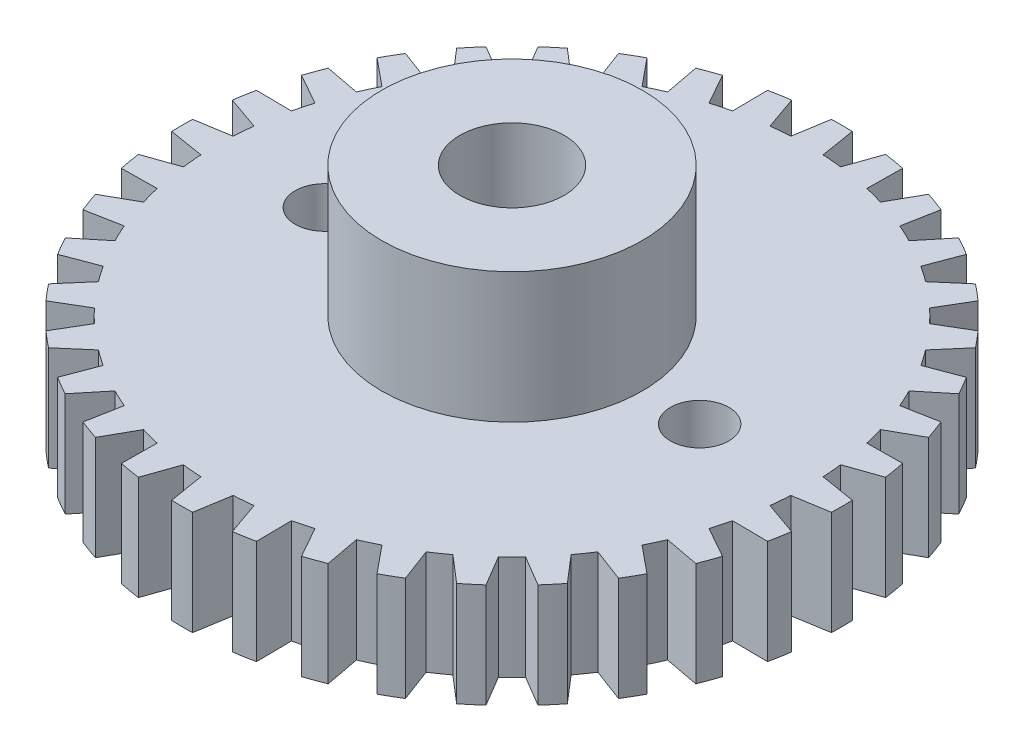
SolidWorks part; units mm, degrees
ref_plane "Front Plane" through (0, 0, 0) normal (0, 0, 1) x (1, 0, 0)
ref_plane "Top Plane" through (0, 0, 0) normal (0, 1, 0) x (1, 0, 0)
ref_plane "Right Plane" through (0, 0, 0) normal (1, 0, 0) x (0, 0, -1)
sketch "Sketch1" plane through (0, 0, 0) normal (0, 1, 0) x (1, 0, 0)
  line L0 (-0.635, 20.0941) -> (-0.9842, 17.969)
  line L1 (0.635, 20.0941) -> (0.9842, 17.969)
  line L2 (4.1147, 19.6785) -> (4.0895, 17.5251)
  line L3 (2.8639, 19.8991) -> (2.151, 17.8669)
  line L4 (7.4693, 18.6651) -> (7.0706, 16.5487)
  line L5 (6.2759, 19.0994) -> (5.2209, 17.2219)
  line L6 (10.597, 17.0845) -> (9.8368, 15.0695)
  line L7 (9.4971, 17.7195) -> (8.1321, 16.0537)
  line L8 (13.4027, 14.9848) -> (12.3042, 13.1324)
  line L9 (12.4298, 15.8011) -> (10.7963, 14.3977)
  line L10 (15.8011, 12.4298) -> (14.3977, 10.7963)
  line L11 (14.9848, 13.4027) -> (13.1324, 12.3042)
  line L12 (17.7195, 9.4971) -> (16.0537, 8.1321)
  line L13 (17.0845, 10.597) -> (15.0695, 9.8368)
  line L14 (19.0994, 6.2759) -> (17.2219, 5.2209)
  line L15 (18.6651, 7.4693) -> (16.5487, 7.0706)
  line L16 (19.8991, 2.8639) -> (17.8669, 2.151)
  line L17 (19.6785, 4.1147) -> (17.5251, 4.0895)
  line L18 (20.0941, -0.635) -> (17.969, -0.9842)
  line L19 (20.0941, 0.635) -> (17.969, 0.9842)
  line L20 (19.6785, -4.1147) -> (17.5251, -4.0895)
  line L21 (19.8991, -2.8639) -> (17.8669, -2.151)
  line L22 (18.6651, -7.4693) -> (16.5487, -7.0706)
  line L23 (19.0994, -6.2759) -> (17.2219, -5.2209)
  line L24 (17.0845, -10.597) -> (15.0695, -9.8368)
  line L25 (17.7195, -9.4971) -> (16.0537, -8.1321)
  line L26 (14.9848, -13.4027) -> (13.1324, -12.3042)
  line L27 (15.8011, -12.4298) -> (14.3977, -10.7963)
  line L28 (12.4298, -15.8011) -> (10.7963, -14.3977)
  line L29 (13.4027, -14.9848) -> (12.3042, -13.1324)
  line L30 (9.4971, -17.7195) -> (8.1321, -16.0537)
  line L31 (10.597, -17.0845) -> (9.8368, -15.0695)
  line L32 (6.2759, -19.0994) -> (5.2209, -17.2219)
  line L33 (7.4693, -18.6651) -> (7.0706, -16.5487)
  line L34 (2.8639, -19.8991) -> (2.151, -17.8669)
  line L35 (4.1147, -19.6785) -> (4.0895, -17.5251)
  line L36 (-0.635, -20.0941) -> (-0.9842, -17.969)
  line L37 (0.635, -20.0941) -> (0.9842, -17.969)
  line L38 (-4.1147, -19.6785) -> (-4.0895, -17.5251)
  line L39 (-2.8639, -19.8991) -> (-2.151, -17.8669)
  line L40 (-7.4693, -18.6651) -> (-7.0706, -16.5487)
  line L41 (-6.2759, -19.0994) -> (-5.2209, -17.2219)
  line L42 (-10.597, -17.0845) -> (-9.8368, -15.0695)
  line L43 (-9.4971, -17.7195) -> (-8.1321, -16.0537)
  line L44 (-13.4027, -14.9848) -> (-12.3042, -13.1324)
  line L45 (-12.4298, -15.8011) -> (-10.7963, -14.3977)
  line L46 (-15.8011, -12.4298) -> (-14.3977, -10.7963)
  line L47 (-14.9848, -13.4027) -> (-13.1324, -12.3042)
  line L48 (-17.7195, -9.4971) -> (-16.0537, -8.1321)
  line L49 (-17.0845, -10.597) -> (-15.0695, -9.8368)
  line L50 (-19.0994, -6.2759) -> (-17.2219, -5.2209)
  line L51 (-18.6651, -7.4693) -> (-16.5487, -7.0706)
  line L52 (-19.8991, -2.8639) -> (-17.8669, -2.151)
  line L53 (-19.6785, -4.1147) -> (-17.5251, -4.0895)
  line L54 (-20.0941, 0.635) -> (-17.969, 0.9842)
  line L55 (-20.0941, -0.635) -> (-17.969, -0.9842)
  line L56 (-19.6785, 4.1147) -> (-17.5251, 4.0895)
  line L57 (-19.8991, 2.8639) -> (-17.8669, 2.151)
  line L58 (-18.6651, 7.4693) -> (-16.5487, 7.0706)
  line L59 (-19.0994, 6.2759) -> (-17.2219, 5.2209)
  line L60 (-17.0845, 10.597) -> (-15.0695, 9.8368)
  line L61 (-17.7195, 9.4971) -> (-16.0537, 8.1321)
  line L62 (-14.9848, 13.4027) -> (-13.1324, 12.3042)
  line L63 (-15.8011, 12.4298) -> (-14.3977, 10.7963)
  line L64 (-12.4298, 15.8011) -> (-10.7963, 14.3977)
  line L65 (-13.4027, 14.9848) -> (-12.3042, 13.1324)
  line L66 (-9.4971, 17.7195) -> (-8.1321, 16.0537)
  line L67 (-10.597, 17.0845) -> (-9.8368, 15.0695)
  line L68 (-6.2759, 19.0994) -> (-5.2209, 17.2219)
  line L69 (-7.4693, 18.6651) -> (-7.0706, 16.5487)
  line L70 (-2.8639, 19.8991) -> (-2.151, 17.8669)
  line L71 (-4.1147, 19.6785) -> (-4.0895, 17.5251)
  circle A0 centre (0, 0) radius 17.9959 construction
  circle A1 centre (0, 0) radius 3.175
  circle A2 centre (0, 0) radius 20.1041 construction
  circle A3 centre (0, 0) radius 19.05 construction
  arc A4 (-0.635, 20.0941) -> (0.635, 20.0941) centre (0, 0) cw
  arc A5 (0.9842, 17.969) -> (2.151, 17.8669) centre (0, 0) cw
  arc A6 (-17.0845, -10.597) -> (-17.7195, -9.4971) centre (0, 0) cw
  arc A7 (2.8639, 19.8991) -> (4.1147, 19.6785) centre (0, 0) cw
  arc A8 (-18.6651, -7.4693) -> (-19.0994, -6.2759) centre (0, 0) cw
  arc A9 (6.2759, 19.0994) -> (7.4693, 18.6651) centre (0, 0) cw
  arc A10 (-19.6785, -4.1147) -> (-19.8991, -2.8639) centre (0, 0) cw
  arc A11 (9.4971, 17.7195) -> (10.597, 17.0845) centre (0, 0) cw
  arc A12 (-20.0941, -0.635) -> (-20.0941, 0.635) centre (0, 0) cw
  arc A13 (12.4298, 15.8011) -> (13.4027, 14.9848) centre (0, 0) cw
  arc A14 (-19.8991, 2.8639) -> (-19.6785, 4.1147) centre (0, 0) cw
  arc A15 (14.9848, 13.4027) -> (15.8011, 12.4298) centre (0, 0) cw
  arc A16 (-19.0994, 6.2759) -> (-18.6651, 7.4693) centre (0, 0) cw
  arc A17 (17.0845, 10.597) -> (17.7195, 9.4971) centre (0, 0) cw
  arc A18 (-17.7195, 9.4971) -> (-17.0845, 10.597) centre (0, 0) cw
  arc A19 (18.6651, 7.4693) -> (19.0994, 6.2759) centre (0, 0) cw
  arc A20 (-15.8011, 12.4298) -> (-14.9848, 13.4027) centre (0, 0) cw
  arc A21 (19.6785, 4.1147) -> (19.8991, 2.8639) centre (0, 0) cw
  arc A22 (-13.4027, 14.9848) -> (-12.4298, 15.8011) centre (0, 0) cw
  arc A23 (20.0941, 0.635) -> (20.0941, -0.635) centre (0, 0) cw
  arc A24 (-10.597, 17.0845) -> (-9.4971, 17.7195) centre (0, 0) cw
  arc A25 (19.8991, -2.8639) -> (19.6785, -4.1147) centre (0, 0) cw
  arc A26 (-7.4693, 18.6651) -> (-6.2759, 19.0994) centre (0, 0) cw
  arc A27 (19.0994, -6.2759) -> (18.6651, -7.4693) centre (0, 0) cw
  arc A28 (-4.1147, 19.6785) -> (-2.8639, 19.8991) centre (0, 0) cw
  arc A29 (17.7195, -9.4971) -> (17.0845, -10.597) centre (0, 0) cw
  arc A30 (4.0895, 17.5251) -> (5.2209, 17.2219) centre (0, 0) cw
  arc A31 (15.8011, -12.4298) -> (14.9848, -13.4027) centre (0, 0) cw
  arc A32 (7.0706, 16.5487) -> (8.1321, 16.0537) centre (0, 0) cw
  arc A33 (13.4027, -14.9848) -> (12.4298, -15.8011) centre (0, 0) cw
  arc A34 (9.8368, 15.0695) -> (10.7963, 14.3977) centre (0, 0) cw
  arc A35 (10.597, -17.0845) -> (9.4971, -17.7195) centre (0, 0) cw
  arc A36 (12.3042, 13.1324) -> (13.1324, 12.3042) centre (0, 0) cw
  arc A37 (7.4693, -18.6651) -> (6.2759, -19.0994) centre (0, 0) cw
  arc A38 (14.3977, 10.7963) -> (15.0695, 9.8368) centre (0, 0) cw
  arc A39 (4.1147, -19.6785) -> (2.8639, -19.8991) centre (0, 0) cw
  arc A40 (16.0537, 8.1321) -> (16.5487, 7.0706) centre (0, 0) cw
  arc A41 (0.635, -20.0941) -> (-0.635, -20.0941) centre (0, 0) cw
  arc A42 (17.2219, 5.2209) -> (17.5251, 4.0895) centre (0, 0) cw
  arc A43 (-2.8639, -19.8991) -> (-4.1147, -19.6785) centre (0, 0) cw
  arc A44 (17.8669, 2.151) -> (17.969, 0.9842) centre (0, 0) cw
  arc A45 (-6.2759, -19.0994) -> (-7.4693, -18.6651) centre (0, 0) cw
  arc A46 (17.969, -0.9842) -> (17.8669, -2.151) centre (0, 0) cw
  arc A47 (-9.4971, -17.7195) -> (-10.597, -17.0845) centre (0, 0) cw
  arc A48 (17.5251, -4.0895) -> (17.2219, -5.2209) centre (0, 0) cw
  arc A49 (-12.4298, -15.8011) -> (-13.4027, -14.9848) centre (0, 0) cw
  arc A50 (16.5487, -7.0706) -> (16.0537, -8.1321) centre (0, 0) cw
  arc A51 (-14.9848, -13.4027) -> (-15.8011, -12.4298) centre (0, 0) cw
  arc A52 (15.0695, -9.8368) -> (14.3977, -10.7963) centre (0, 0) cw
  arc A53 (13.1324, -12.3042) -> (12.3042, -13.1324) centre (0, 0) cw
  arc A54 (10.7963, -14.3977) -> (9.8368, -15.0695) centre (0, 0) cw
  arc A55 (8.1321, -16.0537) -> (7.0706, -16.5487) centre (0, 0) cw
  arc A56 (5.2209, -17.2219) -> (4.0895, -17.5251) centre (0, 0) cw
  arc A57 (2.151, -17.8669) -> (0.9842, -17.969) centre (0, 0) cw
  arc A58 (-0.9842, -17.969) -> (-2.151, -17.8669) centre (0, 0) cw
  arc A59 (-4.0895, -17.5251) -> (-5.2209, -17.2219) centre (0, 0) cw
  arc A60 (-7.0706, -16.5487) -> (-8.1321, -16.0537) centre (0, 0) cw
  arc A61 (-9.8368, -15.0695) -> (-10.7963, -14.3977) centre (0, 0) cw
  arc A62 (-12.3042, -13.1324) -> (-13.1324, -12.3042) centre (0, 0) cw
  arc A63 (-14.3977, -10.7963) -> (-15.0695, -9.8368) centre (0, 0) cw
  arc A64 (-16.0537, -8.1321) -> (-16.5487, -7.0706) centre (0, 0) cw
  arc A65 (-17.2219, -5.2209) -> (-17.5251, -4.0895) centre (0, 0) cw
  arc A66 (-17.8669, -2.151) -> (-17.969, -0.9842) centre (0, 0) cw
  arc A67 (-17.969, 0.9842) -> (-17.8669, 2.151) centre (0, 0) cw
  arc A68 (-17.5251, 4.0895) -> (-17.2219, 5.2209) centre (0, 0) cw
  arc A69 (-16.5487, 7.0706) -> (-16.0537, 8.1321) centre (0, 0) cw
  arc A70 (-15.0695, 9.8368) -> (-14.3977, 10.7963) centre (0, 0) cw
  arc A71 (-13.1324, 12.3042) -> (-12.3042, 13.1324) centre (0, 0) cw
  arc A72 (-10.7963, 14.3977) -> (-9.8368, 15.0695) centre (0, 0) cw
  arc A73 (-8.1321, 16.0537) -> (-7.0706, 16.5487) centre (0, 0) cw
  arc A74 (-5.2209, 17.2219) -> (-4.0895, 17.5251) centre (0, 0) cw
  arc A75 (-2.151, 17.8669) -> (-0.9842, 17.969) centre (0, 0) cw
  point P6 (0, 20.1041)
  point P130 (0, 0)
  dimension "D1" = 38.1
  dimension "D2" = 40.2082
  dimension "D3" = 35.9918
  dimension "D4" = 6.35
  dimension "D5" = 1.27
  dimension "D6" = 36
extrude "Boss-Extrude1" add sketch "Sketch1" along normal blind 6.35
sketch "Sketch2" plane through (0, 6.35, 0) normal (0, 1, 0) x (1, 0, 0)
  circle A0 centre (0, 0) radius 3.175
  circle A1 centre (0, 0) radius 7.9375
  dimension "D1" = 15.875
extrude "Boss-Extrude2" add sketch "Sketch2" along normal blind 7.9375
sketch "Sketch3" plane through (0, 6.35, 0) normal (0, 1, 0) x (1, 0, 0)
  line L0 (-11.43, 0) -> (11.43, 0) construction
  circle A0 centre (11.43, 0) radius 1.778
  circle A1 centre (-11.43, 0) radius 1.778
  dimension "D1" = 22.86
  dimension "D2" = 3.556
extrude "Cut-Extrude1" cut sketch "Sketch3" against normal through all
